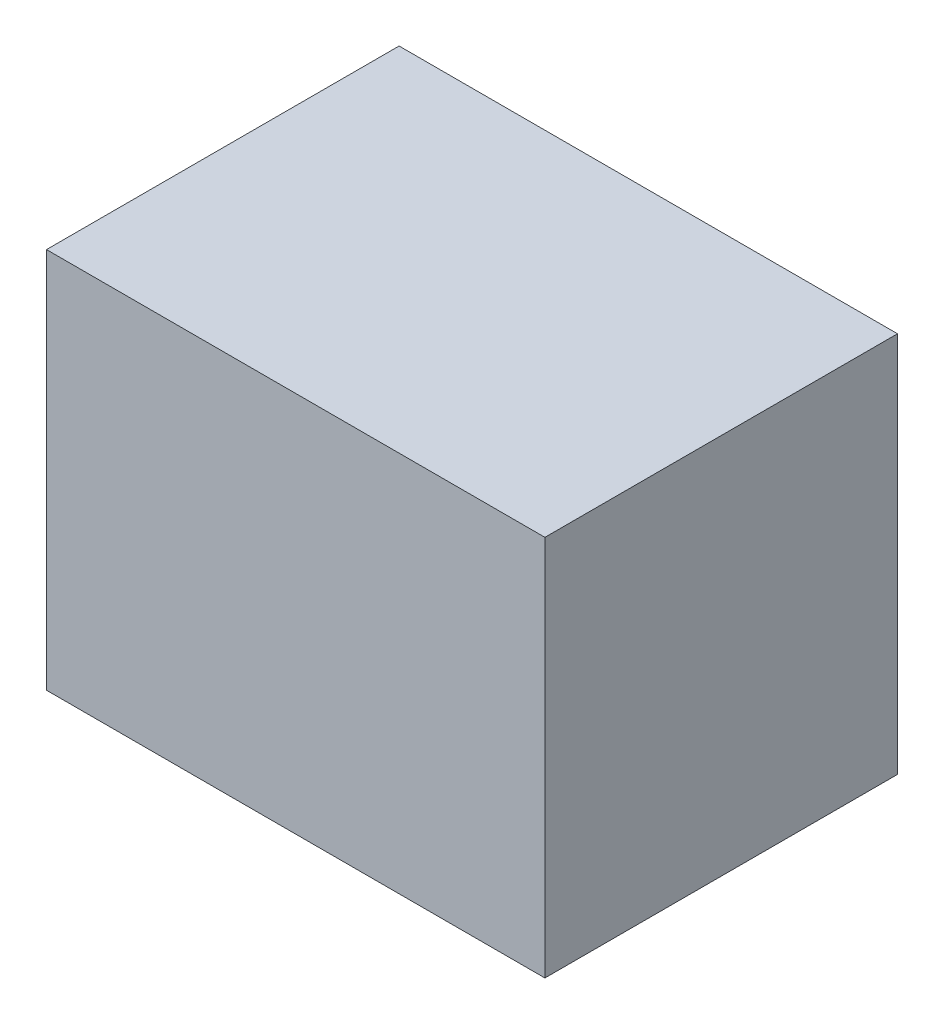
SolidWorks part; units mm, degrees
ref_plane "Front Plane"
ref_plane "Top Plane" through (0, 0, 0) normal (0, 1, 0) x (1, 0, 0)
ref_plane "Right Plane" through (0, 0, 0) normal (1, 0, 0) x (0, 0, -1)
sketch "Sketch1" plane through (0, 0, 0) normal (0, 1, 0) x (1, 0, 0)
  line L1 (-83.0943, 58.7847) -> (83.0943, 58.7847)
  line L2 (-83.0943, 58.7847) -> (-83.0943, -58.7847)
  line L3 (-83.0943, -58.7847) -> (83.0943, -58.7847)
  line L4 (83.0943, 58.7847) -> (83.0943, -58.7847)
  line L5 (-83.0943, 58.7847) -> (83.0943, -58.7847) construction
  line L6 (-83.0943, -58.7847) -> (83.0943, 58.7847) construction
  point P0 (0, 0)
extrude "Boss-Extrude1" add sketch "Sketch1" along normal blind 127.254
shell "Shell1" thickness 2.54
